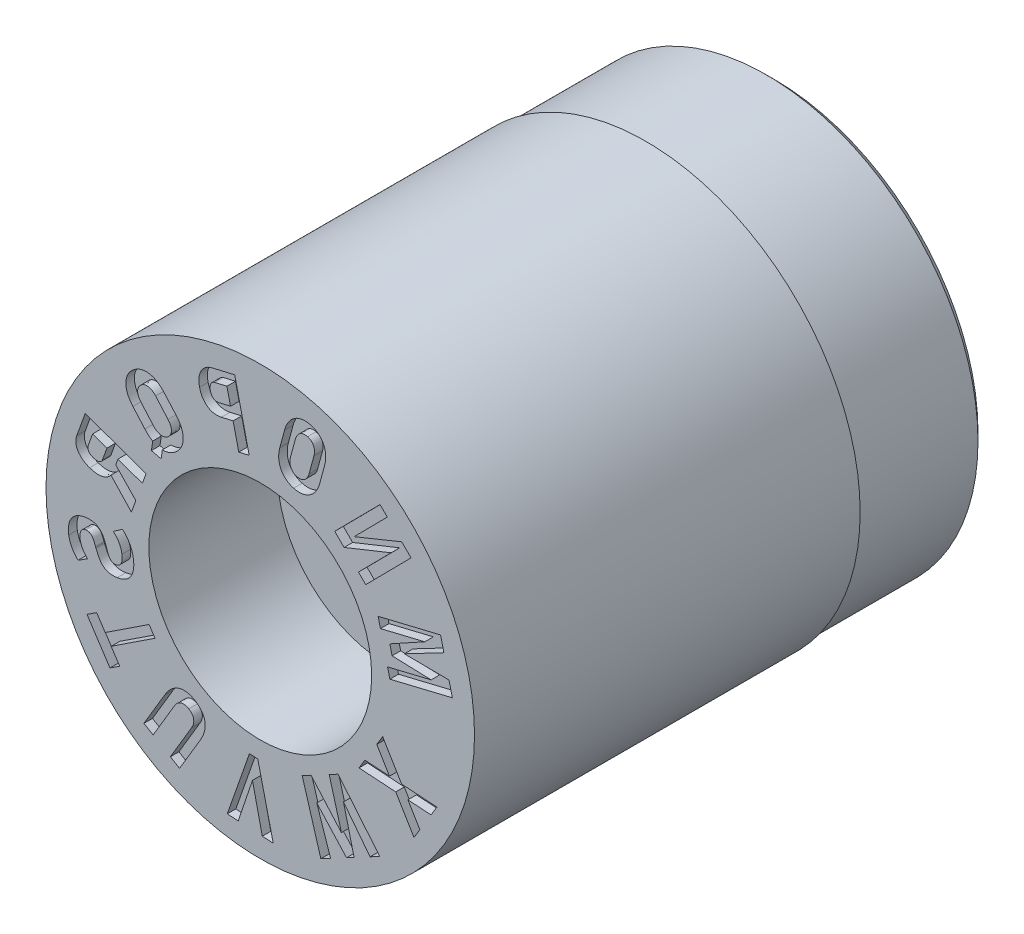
SolidWorks part; units mm, degrees
ref_plane "Front Plane" through (0, 0, 0) normal (0, 0, 1) x (1, 0, 0)
ref_plane "Top Plane" through (0, 0, 0) normal (0, 1, 0) x (1, 0, 0)
ref_plane "Right Plane" through (0, 0, 0) normal (1, 0, 0) x (0, 0, -1)
sketch "Sketch1" plane through (0, 0, 0) normal (1, 0, 0) x (0, 0, -1)
  line L2 (0, 5) -> (0, 2.6)
  line L3 (11.75, 5) -> (0, 5)
  line L4 (-3.7979, 0) -> (49996.2021, 0) construction
  line L8 (12, 1.25) -> (3, 1.25)
  line L9 (3, 2.6) -> (3, 1.25)
  line L10 (3, 2.6) -> (0, 2.6)
  line L12 (12, 1.25) -> (12, 4.75)
  line L16 (12, 4.75) -> (11.75, 5)
  dimension "D1" = 12
  dimension "D2" = 45
  dimension "D3" = 0.25
  dimension "D4" = 10
  dimension "D5" = 5.2
  dimension "D6" = 3
  dimension "D7" = 2.5
revolve "Revolve1" add sketch "Sketch1" angle 360 about L4
sketch "Sketch4" plane through (0, 0, 0) normal (1, 0, 0) x (0, 0, -1)
  line L0 (0, 0) -> (50000, 0) construction
  line L1 (12, -4.75) -> (12, 4.75) construction
  line L2 (9, 5.935) -> (12, 5.935)
  line L3 (9, 5.935) -> (9, 4.935)
  line L4 (9, 4.935) -> (12, 4.935)
  line L5 (12, 5.935) -> (12, 4.935)
  line L6 (11.75, 5) -> (0, 5) construction
  line L9 (0, 5.5) -> (0, -5.5) construction
  dimension "D1" = 1
  dimension "D2" = 0.065
  dimension "D3" = 9
revolve "Cut-Revolve1" cut sketch "Sketch4" angle 360 about L0
sketch "Sketch5" plane through (0, 0, 0) normal (0, 0, 1) x (1, 0, 0)
  line L0 (4.2863, 1.3069) -> (4.2086, 1.6274)
  line L1 (4.2086, 1.6274) -> (2.7506, 1.275)
  line L2 (2.7506, 1.275) -> (2.8042, 1.0542)
  line L3 (2.8042, 1.0542) -> (3.8391, 1.3043)
  line L5 (3.8391, 1.3043) -> (3.0244, 0.8554)
  line L6 (3.0244, 0.8554) -> (3.0763, 0.6405)
  line L7 (3.0763, 0.6405) -> (3.987, 0.6087)
  line L9 (3.987, 0.6087) -> (2.9712, 0.3633)
  line L10 (2.9712, 0.3633) -> (3.0249, 0.1421)
  line L11 (3.0249, 0.1421) -> (4.4829, 0.4945)
  line L12 (4.4829, 0.4945) -> (4.4051, 0.8149)
  line L13 (4.4051, 0.8149) -> (3.363, 0.8236)
  line L14 (3.363, 0.8236) -> (4.2863, 1.3069)
  line L15 (3.5191, 2.8404) -> (3.3012, 3.0557)
  line L16 (3.3012, 3.0557) -> (2.191, 2.6049)
  line L18 (2.191, 2.6049) -> (2.9654, 3.3881)
  line L19 (2.9654, 3.3881) -> (2.7954, 3.5562)
  line L20 (2.7954, 3.5562) -> (1.7379, 2.4868)
  line L21 (1.7379, 2.4868) -> (1.9566, 2.2703)
  line L22 (1.9566, 2.2703) -> (3.0543, 2.711)
  line L24 (3.0543, 2.711) -> (2.2913, 1.9394)
  line L25 (2.2913, 1.9394) -> (2.4615, 1.771)
  line L26 (2.4615, 1.771) -> (3.5191, 2.8404)
  line L27 (1.3901, 3.2863) -> (1.5008, 3.6955)
  line L28 (0.5676, 3.9476) -> (0.4569, 3.5384)
  line L29 (0.7045, 3.4642) -> (0.8189, 3.8872)
  line L30 (1.2534, 3.77) -> (1.1389, 3.347)
  line L31 (-0.694, 3.7981) -> (-0.9749, 3.733)
  line L32 (-1.059, 4.0961) -> (-0.7781, 4.1612)
  line L33 (-0.6327, 3.5334) -> (-0.5016, 2.9677)
  line L34 (-3.3213, 1.4174) -> (-2.7509, 1.2119)
  line L35 (-0.9072, 3.4698) -> (-0.6327, 3.5334)
  line L36 (-3.618, -2.2367) -> (-3.8174, -1.9339)
  line L37 (-0.5961, 4.4821) -> (-1.1138, 4.3622)
  line L38 (-0.7781, 4.1612) -> (-0.694, 3.7981)
  line L39 (-0.5016, 2.9677) -> (-0.2583, 3.024)
  line L40 (-0.2583, 3.024) -> (-0.5961, 4.4821)
  line L42 (-2.51, 2.1875) -> (-2.5402, 1.9795)
  line L43 (-2.5402, 1.9795) -> (-2.3131, 1.9239)
  line L44 (-2.3131, 1.9239) -> (-2.2848, 2.1221)
  line L45 (-1.962, 2.98) -> (-2.2422, 3.2987)
  line L46 (-2.9724, 2.6569) -> (-2.6922, 2.3382)
  line L47 (-2.4921, 2.5047) -> (-2.7818, 2.8338)
  line L48 (-2.4423, 3.1322) -> (-2.1526, 2.8031)
  line L49 (-3.5785, 1.5101) -> (-3.6842, 1.217)
  line L50 (-4.0176, 1.337) -> (-3.9119, 1.6302)
  line L52 (-4.0845, 1.9588) -> (-4.2819, 1.4106)
  line L53 (-3.3727, 1.2746) -> (-3.3213, 1.4174)
  line L56 (-3.9119, 1.6302) -> (-3.5785, 1.5101)
  line L57 (-2.7509, 1.2119) -> (-2.6659, 1.4477)
  line L58 (-2.6659, 1.4477) -> (-4.0845, 1.9588)
  line L60 (-3.4837, 1.0113) -> (-3.0069, 0.5014)
  line L61 (-3.0069, 0.5014) -> (-2.9039, 0.787)
  line L62 (-2.9039, 0.787) -> (-3.3727, 1.2746)
  line L63 (-3.2157, 0.0498) -> (-3.4296, -0.099)
  line L64 (-3.3686, -0.7404) -> (-3.3695, -0.7407)
  line L65 (-3.5814, -0.5246) -> (-3.5871, -0.5053)
  line L66 (-4.0825, -0.1395) -> (-4.0837, -0.1399)
  line L67 (-4.2525, -1.0932) -> (-4.0304, -0.9538)
  line L68 (-4.0745, -0.3902) -> (-4.0733, -0.3902)
  line L69 (-3.3398, -0.9882) -> (-3.3377, -0.9879)
  line L71 (-3.4801, -2.4461) -> (-2.4564, -1.7722)
  line L72 (-2.4564, -1.7722) -> (-2.5944, -1.5629)
  line L73 (-2.5944, -1.5629) -> (-3.618, -2.2367)
  line L74 (-4.0442, -2.0834) -> (-3.5076, -2.8983)
  line L75 (-3.5076, -2.8983) -> (-3.2807, -2.7489)
  line L76 (-3.2807, -2.7489) -> (-3.4801, -2.4461)
  line L77 (-3.8174, -1.9339) -> (-4.0442, -2.0834)
  line L78 (-2.2251, -2.7968) -> (-2.7148, -3.6211)
  line L79 (-2.7148, -3.6211) -> (-2.5002, -3.7485)
  line L80 (-2.5002, -3.7485) -> (-2.0067, -2.9177)
  line L81 (-1.6042, -3.1568) -> (-2.0976, -3.9876)
  line L82 (-2.0976, -3.9876) -> (-1.8833, -4.1152)
  line L83 (-1.8833, -4.1152) -> (-1.3936, -3.291)
  line L84 (-0.7696, -4.4781) -> (-0.5138, -4.4916)
  line L85 (-0.5138, -4.4916) -> (-0.1812, -3.5057)
  line L86 (-0.1812, -3.5057) -> (0.0471, -4.521)
  line L87 (0.0471, -4.521) -> (0.3029, -4.5342)
  line L88 (0.3029, -4.5342) -> (-0.058, -3.0114)
  line L89 (-0.058, -3.0114) -> (-0.2521, -3.0012)
  line L90 (-0.2521, -3.0012) -> (-0.7696, -4.4781)
  line L91 (2.0133, -3.9732) -> (2.1899, -3.8788)
  line L92 (2.1899, -3.8788) -> (1.9428, -2.8793)
  line L93 (1.9428, -2.8793) -> (2.5627, -3.6796)
  line L94 (2.5627, -3.6796) -> (2.7894, -3.5588)
  line L95 (2.7894, -3.5588) -> (1.8159, -2.3826)
  line L96 (1.8159, -2.3826) -> (1.609, -2.4932)
  line L97 (1.609, -2.4932) -> (1.8941, -3.5255)
  line L98 (1.8941, -3.5255) -> (1.1853, -2.7193)
  line L99 (1.1853, -2.7193) -> (0.9785, -2.8299)
  line L100 (0.9785, -2.8299) -> (1.4139, -4.2932)
  line L101 (1.4139, -4.2932) -> (1.6402, -4.1722)
  line L102 (1.6402, -4.1722) -> (1.3202, -3.2118)
  line L103 (1.3202, -3.2118) -> (2.0133, -3.9732)
  line L105 (3.1621, -2.0673) -> (3.5872, -2.7775)
  line L106 (3.5872, -2.7775) -> (3.7244, -2.5515)
  line L107 (3.7244, -2.5515) -> (3.4456, -2.0857)
  line L109 (3.2987, -1.841) -> (2.8571, -1.1022)
  line L110 (2.8571, -1.1022) -> (2.7195, -1.3283)
  line L111 (2.7195, -1.3283) -> (3.0157, -1.8226)
  line L112 (3.4456, -2.0857) -> (3.9859, -2.1208)
  line L113 (3.9859, -2.1208) -> (4.1232, -1.8948)
  line L114 (4.1232, -1.8948) -> (3.2987, -1.841)
  line L115 (3.0157, -1.8226) -> (2.4421, -1.7853)
  line L116 (2.4421, -1.7853) -> (2.3047, -2.0118)
  line L117 (2.3047, -2.0118) -> (3.1621, -2.0673)
  circle A0 centre (0, 0) radius 3.0592 construction
  spline S0 degree 3 poles (0.7798, 2.8798) (0.8024, 2.8742) (0.8362, 2.8663) (0.8816, 2.8622) (0.9147, 2.861) (0.9474, 2.8619) (0.9796, 2.8656) (1.0113, 2.8714) (1.0425, 2.8796) (1.0729, 2.8901) (1.1023, 2.9026) (1.1307, 2.9173) (1.1581, 2.9341) (1.1845, 2.953) (1.2097, 2.974) (1.2342, 2.997) (1.2573, 3.0222) (1.2791, 3.0493) (1.2993, 3.0783) (1.3186, 3.1086) (1.3359, 3.1409) (1.3517, 3.1749) (1.371, 3.223) (1.3835, 3.2605) (1.3901, 3.2863) knots 0 0 0 0 0.084854 0.125633 0.16558 0.205361 0.244558 0.283175 0.322471 0.36161 0.399992 0.438636 0.477754 0.516725 0.556575 0.597135 0.638485 0.68082 0.723586 0.766957 0.81144 0.856452 0.90324 1 1 1 1
  spline S1 degree 3 poles (1.5008, 3.6955) (1.5141, 3.7456) (1.528, 3.8209) (1.5283, 3.9206) (1.5214, 3.9793) (1.5118, 4.0242) (1.5023, 4.0563) (1.4913, 4.0873) (1.4782, 4.117) (1.4625, 4.145) (1.4457, 4.1721) (1.4265, 4.1978) (1.4053, 4.222) (1.3826, 4.245) (1.358, 4.2659) (1.3321, 4.2853) (1.3045, 4.3028) (1.2753, 4.3184) (1.2335, 4.3368) (1.2008, 4.348) (1.1782, 4.354) knots 0 0 0 0 0.188634 0.276447 0.361357 0.403048 0.443403 0.483105 0.522381 0.561263 0.599706 0.638378 0.677507 0.716596 0.755761 0.794913 0.83421 0.874247 0.91524 1 1 1 1
  spline S2 degree 3 poles (1.1782, 4.354) (1.1557, 4.3605) (1.1217, 4.3669) (1.0764, 4.3722) (1.0431, 4.3732) (1.0104, 4.3723) (0.9783, 4.3686) (0.9465, 4.3628) (0.9155, 4.3545) (0.885, 4.3444) (0.8556, 4.3316) (0.8273, 4.3169) (0.7997, 4.3004) (0.7735, 4.2812) (0.7481, 4.2603) (0.7239, 4.2369) (0.7007, 4.2117) (0.679, 4.1844) (0.6582, 4.1558) (0.6395, 4.1252) (0.6223, 4.093) (0.6059, 4.0592) (0.5867, 4.0109) (0.5742, 3.9734) (0.5676, 3.9476) knots 0 0 0 0 0.084835 0.125779 0.165706 0.205468 0.244647 0.283245 0.322521 0.361362 0.400022 0.438647 0.477421 0.516711 0.556542 0.596979 0.638671 0.680985 0.723764 0.767103 0.811194 0.856522 0.903287 1 1 1 1
  spline S3 degree 3 poles (0.4569, 3.5384) (0.4434, 3.4883) (0.4299, 3.413) (0.4299, 3.3134) (0.4366, 3.2549) (0.4464, 3.2101) (0.4554, 3.1778) (0.4671, 3.1472) (0.4798, 3.1173) (0.4953, 3.0892) (0.5122, 3.0621) (0.5313, 3.0364) (0.5525, 3.0122) (0.5753, 2.9892) (0.5999, 2.9683) (0.6258, 2.9489) (0.6534, 2.9314) (0.6828, 2.9158) (0.7243, 2.8967) (0.7573, 2.8859) (0.7798, 2.8798) knots 0 0 0 0 0.188814 0.276321 0.361246 0.40242 0.443038 0.482795 0.521777 0.560858 0.599307 0.637986 0.677121 0.716217 0.755389 0.794547 0.833851 0.874265 0.915226 1 1 1 1
  spline S4 degree 3 poles (0.8535, 3.1521) (0.833, 3.1579) (0.8034, 3.1694) (0.7694, 3.1932) (0.7473, 3.2137) (0.7288, 3.2376) (0.7133, 3.2637) (0.7027, 3.2929) (0.6946, 3.324) (0.6913, 3.3573) (0.6917, 3.4046) (0.6982, 3.4404) (0.7045, 3.4642) knots 0 0 0 0 0.164569 0.241873 0.319306 0.396246 0.474065 0.552893 0.635179 0.721192 0.809933 1 1 1 1
  spline S5 degree 3 poles (0.8189, 3.8872) (0.8253, 3.911) (0.8377, 3.9452) (0.861, 3.9863) (0.8808, 4.0132) (0.9032, 4.0363) (0.9273, 4.056) (0.9537, 4.0713) (0.9818, 4.0822) (1.0112, 4.0891) (1.0527, 4.0924) (1.0841, 4.0876) (1.1047, 4.0819) knots 0 0 0 0 0.189969 0.278747 0.364115 0.446619 0.525697 0.603457 0.680631 0.757324 0.835779 1 1 1 1
  spline S6 degree 3 poles (1.1047, 4.0819) (1.1252, 4.0766) (1.1547, 4.0649) (1.1889, 4.0412) (1.2107, 4.0202) (1.2294, 3.9966) (1.2446, 3.9704) (1.2553, 3.9412) (1.2629, 3.91) (1.2667, 3.8769) (1.2661, 3.8295) (1.2597, 3.7938) (1.2534, 3.77) knots 0 0 0 0 0.164009 0.24213 0.319774 0.396746 0.473914 0.552775 0.63566 0.721078 0.809855 1 1 1 1
  spline S7 degree 3 poles (1.1389, 3.347) (1.1326, 3.3232) (1.1202, 3.289) (1.0968, 3.2478) (1.077, 3.2208) (1.0546, 3.1977) (1.0305, 3.1781) (1.0042, 3.163) (0.9763, 3.1517) (0.9468, 3.1451) (0.9054, 3.1423) (0.8739, 3.1462) (0.8535, 3.1521) knots 0 0 0 0 0.190103 0.278943 0.365153 0.447715 0.526115 0.60393 0.680672 0.757993 0.836057 1 1 1 1
  spline S8 degree 3 poles (-0.9749, 3.733) (-0.9887, 3.73) (-1.0099, 3.7277) (-1.0375, 3.7316) (-1.0572, 3.7374) (-1.0757, 3.7465) (-1.0935, 3.7576) (-1.1093, 3.7724) (-1.124, 3.7893) (-1.1373, 3.8087) (-1.152, 3.8385) (-1.1602, 3.8626) (-1.1638, 3.8795) knots 0 0 0 0 0.159217 0.234811 0.31068 0.387798 0.46505 0.544886 0.628703 0.716277 0.806375 1 1 1 1
  spline S9 degree 3 poles (-1.1638, 3.8795) (-1.1681, 3.8965) (-1.1715, 3.9221) (-1.1714, 3.9557) (-1.1684, 3.9791) (-1.1629, 4.0011) (-1.1552, 4.0215) (-1.1447, 4.0397) (-1.1319, 4.0559) (-1.1167, 4.0699) (-1.0932, 4.0855) (-1.0731, 4.0931) (-1.059, 4.0961) knots 0 0 0 0 0.194026 0.28503 0.371572 0.455815 0.535818 0.612326 0.688684 0.764158 0.840582 1 1 1 1
  spline S10 degree 3 poles (-1.1138, 4.3622) (-1.1521, 4.3533) (-1.2073, 4.3342) (-1.2724, 4.2941) (-1.3146, 4.2584) (-1.3508, 4.2175) (-1.3812, 4.1718) (-1.4046, 4.1215) (-1.4212, 4.0671) (-1.4317, 4.0092) (-1.4344, 3.9262) (-1.4263, 3.8632) (-1.4163, 3.8212) knots 0 0 0 0 0.169181 0.248916 0.327591 0.405822 0.483634 0.562501 0.64375 0.727835 0.814528 1 1 1 1
  spline S11 degree 3 poles (-1.4163, 3.8212) (-1.407, 3.779) (-1.3865, 3.7186) (-1.3471, 3.6457) (-1.3126, 3.5982) (-1.2736, 3.5571) (-1.2305, 3.5224) (-1.1835, 3.4947) (-1.1327, 3.4744) (-1.0793, 3.4613) (-1.0033, 3.4537) (-0.9454, 3.4614) (-0.9072, 3.4698) knots 0 0 0 0 0.186189 0.272787 0.356605 0.438128 0.516309 0.594256 0.672298 0.751181 0.830638 1 1 1 1
  spline S12 degree 3 poles (-1.9623, 2.2449) (-1.945, 2.2606) (-1.9198, 2.2846) (-1.8907, 2.32) (-1.8714, 2.3472) (-1.8543, 2.3752) (-1.8389, 2.4039) (-1.8262, 2.4337) (-1.8124, 2.4744) (-1.8005, 2.527) (-1.796, 2.5916) (-1.8007, 2.6574) (-1.8123, 2.7124) (-1.826, 2.7564) (-1.839, 2.7894) (-1.8537, 2.8221) (-1.871, 2.8543) (-1.8902, 2.8865) (-1.9197, 2.9293) (-1.9444, 2.9601) (-1.962, 2.98) knots 0 0 0 0 0.08482 0.125834 0.166007 0.205706 0.244763 0.283952 0.323161 0.400716 0.478449 0.55723 0.639391 0.681721 0.724221 0.767703 0.811694 0.856943 0.90353 1 1 1 1
  spline S13 degree 3 poles (-2.2422, 3.2987) (-2.2767, 3.3374) (-2.3318, 3.3907) (-2.4148, 3.4459) (-2.4676, 3.4729) (-2.5107, 3.489) (-2.5427, 3.4992) (-2.5748, 3.5067) (-2.6068, 3.5122) (-2.6389, 3.5151) (-2.671, 3.5155) (-2.7031, 3.5138) (-2.7351, 3.5097) (-2.7666, 3.5028) (-2.7979, 3.4944) (-2.8284, 3.4831) (-2.8583, 3.4694) (-2.8878, 3.4537) (-2.9263, 3.4289) (-2.954, 3.4079) (-2.9714, 3.3922) knots 0 0 0 0 0.188187 0.275929 0.360881 0.402284 0.442801 0.482544 0.521736 0.56056 0.599241 0.637939 0.676924 0.71607 0.754979 0.794146 0.834133 0.874121 0.915041 1 1 1 1
  spline S14 degree 3 poles (-2.9714, 3.3922) (-2.989, 3.3767) (-3.0137, 3.352) (-3.0434, 3.317) (-3.0625, 3.2897) (-3.0799, 3.2619) (-3.095, 3.2331) (-3.108, 3.2034) (-3.1216, 3.1627) (-3.1339, 3.1103) (-3.1383, 3.0456) (-3.1337, 2.9799) (-3.122, 2.925) (-3.1082, 2.881) (-3.0956, 2.848) (-3.0805, 2.8153) (-3.0634, 2.7829) (-3.0441, 2.7507) (-3.0145, 2.7079) (-2.9902, 2.6768) (-2.9724, 2.6569) knots 0 0 0 0 0.085083 0.126278 0.166434 0.20578 0.245168 0.283985 0.323178 0.400735 0.478436 0.557185 0.638964 0.681276 0.724083 0.767234 0.811508 0.856738 0.903306 1 1 1 1
  spline S15 degree 3 poles (-2.6922, 2.3382) (-2.6577, 2.2996) (-2.6027, 2.2462) (-2.5365, 2.2024) (-2.5128, 2.189) (-2.51, 2.1875) knots 0 0 0 0 0.188096 0.275632 0.286883 0.286883 0.286883 0.286883
  spline S16 degree 3 poles (-2.1488, 2.4568) (-2.1647, 2.4422) (-2.1914, 2.4246) (-2.2301, 2.4087) (-2.2596, 2.4017) (-2.2896, 2.399) (-2.32, 2.4011) (-2.3504, 2.408) (-2.3806, 2.4191) (-2.4103, 2.4344) (-2.4497, 2.4607) (-2.4759, 2.4861) (-2.4921, 2.5047) knots 0 0 0 0 0.165329 0.24357 0.3207 0.397703 0.474638 0.554093 0.636026 0.721784 0.810093 1 1 1 1
  spline S17 degree 3 poles (-2.7818, 2.8338) (-2.7982, 2.8524) (-2.8196, 2.8818) (-2.8411, 2.9241) (-2.8524, 2.9554) (-2.8597, 2.9867) (-2.8622, 3.0177) (-2.8601, 3.0481) (-2.8539, 3.0777) (-2.8433, 3.1063) (-2.823, 3.1429) (-2.8013, 3.1665) (-2.7852, 3.1807) knots 0 0 0 0 0.190296 0.278273 0.363742 0.44551 0.524772 0.601669 0.679459 0.756595 0.834986 1 1 1 1
  spline S18 degree 3 poles (-2.7852, 3.1807) (-2.7692, 3.1948) (-2.7429, 3.2128) (-2.7042, 3.2285) (-2.6746, 3.2355) (-2.6444, 3.2378) (-2.6141, 3.2357) (-2.5837, 3.2293) (-2.5535, 3.2181) (-2.5239, 3.2028) (-2.4849, 3.176) (-2.4584, 3.1509) (-2.4423, 3.1322) knots 0 0 0 0 0.164324 0.242648 0.320594 0.397515 0.474532 0.554006 0.636026 0.721138 0.809891 1 1 1 1
  spline S19 degree 3 poles (-2.1526, 2.8031) (-2.1365, 2.7845) (-2.1146, 2.7554) (-2.0933, 2.7131) (-2.0819, 2.6818) (-2.0747, 2.6503) (-2.0722, 2.6193) (-2.0739, 2.5889) (-2.0802, 2.5593) (-2.0911, 2.5309) (-2.1113, 2.4944) (-2.1328, 2.4708) (-2.1488, 2.4568) knots 0 0 0 0 0.189978 0.278085 0.363682 0.446309 0.525689 0.602752 0.679876 0.757305 0.835813 1 1 1 1
  spline S20 degree 3 poles (-3.6842, 1.217) (-3.6882, 1.2054) (-3.6967, 1.1891) (-3.7131, 1.1713) (-3.7275, 1.1604) (-3.7437, 1.1516) (-3.7614, 1.1445) (-3.781, 1.1405) (-3.802, 1.1388) (-3.8241, 1.1395) (-3.8555, 1.1431) (-3.8791, 1.1494) (-3.8948, 1.1547) knots 0 0 0 0 0.149319 0.221694 0.294551 0.369529 0.446511 0.527282 0.612762 0.703263 0.796934 1 1 1 1
  spline S21 degree 3 poles (-3.8948, 1.1547) (-3.9108, 1.1599) (-3.9328, 1.1706) (-3.96, 1.1871) (-3.977, 1.2011) (-3.9919, 1.2157) (-4.0045, 1.2311) (-4.0138, 1.2478) (-4.0208, 1.2649) (-4.0246, 1.2827) (-4.0256, 1.3071) (-4.0222, 1.3253) (-4.0176, 1.337) knots 0 0 0 0 0.203595 0.297556 0.386975 0.471746 0.551629 0.628662 0.703686 0.776223 0.848313 1 1 1 1
  spline S22 degree 3 poles (-4.2819, 1.4106) (-4.294, 1.378) (-4.3047, 1.3273) (-4.3045, 1.2593) (-4.2957, 1.2101) (-4.2802, 1.1625) (-4.2568, 1.1171) (-4.2268, 1.0743) (-4.1899, 1.0341) (-4.1464, 0.9976) (-4.0792, 0.952) (-4.022, 0.9267) (-3.9822, 0.9122) knots 0 0 0 0 0.159553 0.235612 0.311315 0.388075 0.465029 0.544636 0.627784 0.714856 0.805171 1 1 1 1
  spline S23 degree 3 poles (-3.9822, 0.9122) (-3.9425, 0.8973) (-3.8822, 0.8818) (-3.8017, 0.8728) (-3.7449, 0.8738) (-3.6909, 0.881) (-3.6403, 0.8946) (-3.5938, 0.9155) (-3.5512, 0.9422) (-3.5139, 0.9742) (-3.493, 0.9988) (-3.4837, 1.0113) knots 0 0 0 0 0.194722 0.284886 0.37192 0.455138 0.534537 0.611839 0.688719 0.76519 0.836633 0.836633 0.836633 0.836633
  spline S24 degree 3 poles (-2.9598, -0.4201) (-2.964, -0.3888) (-2.9741, -0.3426) (-2.9917, -0.2823) (-3.0076, -0.2382) (-3.0258, -0.1956) (-3.0466, -0.1546) (-3.0696, -0.1152) (-3.0951, -0.0778) (-3.1222, -0.0422) (-3.1614, 0.0014) (-3.1927, 0.032) (-3.2157, 0.0498) knots 0 0 0 0 0.172685 0.258677 0.344258 0.429171 0.512627 0.596052 0.678697 0.760721 0.840906 1 1 1 1
  spline S25 degree 3 poles (-3.4296, -0.099) (-3.4024, -0.1208) (-3.3654, -0.1579) (-3.3228, -0.2135) (-3.295, -0.2588) (-3.2712, -0.3065) (-3.2446, -0.3722) (-3.2327, -0.424) (-3.2276, -0.4589) knots 0 0 0 0 0.246996 0.371005 0.497151 0.624435 0.749538 1 1 1 1
  spline S26 degree 3 poles (-3.2276, -0.4589) (-3.2249, -0.478) (-3.2216, -0.5061) (-3.2219, -0.5428) (-3.2232, -0.5681) (-3.2264, -0.5919) (-3.2314, -0.6141) (-3.2379, -0.635) (-3.2465, -0.654) (-3.256, -0.6718) (-3.2679, -0.6873) (-3.2808, -0.7012) (-3.2953, -0.7133) (-3.3115, -0.7231) (-3.3357, -0.7336) (-3.3552, -0.7384) (-3.3686, -0.7404) knots 0 0 0 0 0.163212 0.238687 0.310057 0.377124 0.441113 0.5025 0.561162 0.617797 0.672569 0.725446 0.777915 0.831392 0.885228 1 1 1 1
  spline S27 degree 3 poles (-3.3695, -0.7407) (-3.3874, -0.7438) (-3.4139, -0.7437) (-3.4471, -0.7356) (-3.468, -0.7246) (-3.4866, -0.7107) (-3.5033, -0.6942) (-3.518, -0.6749) (-3.5307, -0.6528) (-3.5424, -0.6277) (-3.5588, -0.5883) (-3.5705, -0.5568) (-3.5778, -0.5344) knots 0 0 0 0 0.167077 0.241681 0.312795 0.383261 0.455172 0.528631 0.606108 0.689828 0.783416 1 1 1 1
  spline S28 degree 3 poles (-3.5778, -0.5344) (-3.5783, -0.5328) (-3.5794, -0.5295) (-3.5802, -0.526) (-3.5814, -0.5246) knots 0 0 0 0 0.496792 1 1 1 1
  spline S29 degree 3 poles (-3.5871, -0.5053) (-3.6004, -0.4657) (-3.6207, -0.409) (-3.6528, -0.3392) (-3.6765, -0.2943) (-3.7039, -0.2541) (-3.7377, -0.2193) (-3.7774, -0.1886) (-3.815, -0.167) (-3.8483, -0.1527) (-3.8758, -0.1438) (-3.9054, -0.1378) (-3.9369, -0.1335) (-3.9704, -0.1318) (-4.0194, -0.1321) (-4.0569, -0.1359) (-4.0825, -0.1395) knots 0 0 0 0 0.181067 0.260489 0.332708 0.40112 0.470234 0.542037 0.617915 0.65743 0.699065 0.742723 0.788179 0.836915 0.887918 1 1 1 1
  spline S30 degree 3 poles (-4.0837, -0.1399) (-4.1069, -0.143) (-4.1408, -0.15) (-4.1844, -0.1622) (-4.2149, -0.1732) (-4.2439, -0.1855) (-4.2715, -0.1993) (-4.2974, -0.2149) (-4.3216, -0.2323) (-4.344, -0.2511) (-4.3652, -0.271) (-4.3843, -0.2925) (-4.4014, -0.3157) (-4.4175, -0.3397) (-4.431, -0.3656) (-4.4434, -0.3926) (-4.4572, -0.431) (-4.4703, -0.4825) (-4.4798, -0.5735) (-4.4764, -0.6442) (-4.469, -0.6921) knots 0 0 0 0 0.091894 0.135435 0.177445 0.218865 0.259058 0.298297 0.337205 0.375493 0.413186 0.450869 0.488257 0.525951 0.564082 0.602598 0.642304 0.723962 0.810241 1 1 1 1
  spline S31 degree 3 poles (-4.469, -0.6921) (-4.4658, -0.716) (-4.4575, -0.7516) (-4.4434, -0.7987) (-4.4254, -0.8462) (-4.3977, -0.9048) (-4.3428, -0.995) (-4.2909, -1.056) (-4.2525, -1.0932) knots 0 0 0 0 0.156128 0.235901 0.317864 0.484671 0.654494 1 1 1 1
  spline S32 degree 3 poles (-4.0304, -0.9538) (-4.0532, -0.9318) (-4.085, -0.8968) (-4.1217, -0.8466) (-4.1459, -0.8084) (-4.1658, -0.7695) (-4.1875, -0.7188) (-4.1971, -0.6793) (-4.2012, -0.6533) knots 0 0 0 0 0.2704 0.40157 0.530661 0.655468 0.774418 1 1 1 1
  spline S33 degree 3 poles (-4.2012, -0.6533) (-4.2064, -0.6192) (-4.2091, -0.5699) (-4.1997, -0.5083) (-4.1882, -0.4761) (-4.1758, -0.4538) (-4.1654, -0.4392) (-4.1537, -0.4263) (-4.1405, -0.4154) (-4.1259, -0.4063) (-4.1042, -0.3965) (-4.0868, -0.3916) (-4.0745, -0.3902) knots 0 0 0 0 0.314658 0.447071 0.567546 0.624824 0.679207 0.731418 0.783129 0.835307 0.887973 1 1 1 1
  spline S34 degree 3 poles (-4.0733, -0.3902) (-4.0539, -0.3871) (-4.0252, -0.3869) (-3.9894, -0.3956) (-3.9669, -0.4075) (-3.9471, -0.4224) (-3.9289, -0.4395) (-3.9137, -0.4595) (-3.9, -0.4818) (-3.8871, -0.5077) (-3.8677, -0.5508) (-3.8534, -0.5859) (-3.844, -0.611) knots 0 0 0 0 0.167349 0.241493 0.312252 0.38306 0.453191 0.524266 0.596439 0.676967 0.770953 1 1 1 1
  spline S35 degree 3 poles (-3.844, -0.611) (-3.8429, -0.6131) (-3.842, -0.618) (-3.8398, -0.6224) (-3.839, -0.6248) knots 0 0 0 0 0.478861 1 1 1 1
  spline S36 degree 3 poles (-3.839, -0.6248) (-3.8379, -0.6284) (-3.835, -0.635) (-3.8321, -0.6417) (-3.8311, -0.6451) knots 0 0 0 0 0.507004 1 1 1 1
  spline S37 degree 3 poles (-3.8311, -0.6451) (-3.8163, -0.6824) (-3.7948, -0.7362) (-3.7601, -0.8017) (-3.7349, -0.8444) (-3.7061, -0.8825) (-3.6715, -0.9152) (-3.6317, -0.9437) (-3.5945, -0.9637) (-3.5618, -0.9768) (-3.5352, -0.9845) (-3.5068, -0.9902) (-3.4768, -0.9941) (-3.4449, -0.9954) (-3.399, -0.995) (-3.3638, -0.9919) (-3.3398, -0.9882) knots 0 0 0 0 0.180519 0.259997 0.333498 0.403308 0.474159 0.546693 0.623198 0.663366 0.70482 0.747886 0.793456 0.84101 0.891072 1 1 1 1
  spline S38 degree 3 poles (-3.3377, -0.9879) (-3.315, -0.9843) (-3.2814, -0.9781) (-3.2385, -0.9653) (-3.2082, -0.9546) (-3.1796, -0.942) (-3.1525, -0.9276) (-3.127, -0.9115) (-3.1031, -0.8938) (-3.0805, -0.875) (-3.0602, -0.854) (-3.0412, -0.832) (-3.0242, -0.8083) (-3.0087, -0.7833) (-2.9953, -0.7566) (-2.9835, -0.7285) (-2.9698, -0.6888) (-2.9575, -0.6356) (-2.9479, -0.542) (-2.9526, -0.4693) (-2.9598, -0.4201) knots 0 0 0 0 0.089182 0.131807 0.173316 0.213508 0.252983 0.291963 0.330167 0.368157 0.40561 0.443269 0.480688 0.518415 0.556944 0.59621 0.636402 0.719477 0.807066 1 1 1 1
  spline S39 degree 3 poles (-1.5245, -2.5627) (-1.5458, -2.5502) (-1.5779, -2.5331) (-1.6221, -2.5148) (-1.6544, -2.5038) (-1.6869, -2.4957) (-1.719, -2.4899) (-1.751, -2.4862) (-1.7828, -2.4855) (-1.8143, -2.4869) (-1.8453, -2.491) (-1.876, -2.4971) (-1.9062, -2.506) (-1.9361, -2.5173) (-1.9652, -2.5313) (-1.9942, -2.5473) (-2.0225, -2.5661) (-2.0506, -2.5868) (-2.0777, -2.61) (-2.1039, -2.6356) (-2.1297, -2.6632) (-2.1548, -2.6933) (-2.1877, -2.7373) (-2.2108, -2.7723) (-2.2251, -2.7968) knots 0 0 0 0 0.088265 0.129982 0.170724 0.210436 0.249307 0.28752 0.325398 0.363047 0.400199 0.437199 0.474867 0.512747 0.551073 0.590431 0.631013 0.672602 0.715056 0.758555 0.803498 0.850122 0.898557 1 1 1 1
  spline S40 degree 3 poles (-2.0067, -2.9177) (-1.9965, -2.9001) (-1.9796, -2.8755) (-1.9546, -2.8459) (-1.9355, -2.8271) (-1.9158, -2.8107) (-1.8954, -2.7966) (-1.874, -2.7854) (-1.8521, -2.7766) (-1.8298, -2.7703) (-1.8072, -2.7666) (-1.7843, -2.7663) (-1.7612, -2.7679) (-1.738, -2.773) (-1.7058, -2.783) (-1.6826, -2.7946) (-1.6675, -2.8035) knots 0 0 0 0 0.150535 0.219854 0.285596 0.348467 0.408969 0.468424 0.526016 0.583153 0.639089 0.694959 0.751524 0.809722 0.870393 1 1 1 1
  spline S41 degree 3 poles (-1.6675, -2.8035) (-1.6525, -2.8128) (-1.6308, -2.8273) (-1.6066, -2.851) (-1.5908, -2.869) (-1.5782, -2.8888) (-1.5676, -2.9092) (-1.5597, -2.9309) (-1.5545, -2.9535) (-1.5513, -2.9769) (-1.5513, -3.0011) (-1.5536, -3.0257) (-1.5583, -3.0511) (-1.5661, -3.0768) (-1.5798, -3.113) (-1.5938, -3.1394) (-1.6042, -3.1568) knots 0 0 0 0 0.130261 0.190753 0.249004 0.306183 0.362454 0.418565 0.475334 0.533275 0.591998 0.652531 0.715434 0.781197 0.850345 1 1 1 1
  spline S42 degree 3 poles (-1.3936, -3.291) (-1.3791, -3.2665) (-1.3587, -3.2298) (-1.3364, -3.1796) (-1.322, -3.1432) (-1.3098, -3.1074) (-1.3001, -3.072) (-1.2926, -3.0371) (-1.2878, -3.0026) (-1.2847, -2.9687) (-1.285, -2.9355) (-1.2866, -2.9031) (-1.2915, -2.8716) (-1.298, -2.8406) (-1.307, -2.8105) (-1.3189, -2.7814) (-1.3326, -2.7529) (-1.3486, -2.7252) (-1.3674, -2.6989) (-1.3879, -2.6732) (-1.4107, -2.6488) (-1.436, -2.6256) (-1.4732, -2.5956) (-1.5032, -2.5749) (-1.5245, -2.5627) knots 0 0 0 0 0.101539 0.149563 0.196051 0.241106 0.284589 0.327167 0.368495 0.408959 0.448359 0.486932 0.524914 0.562096 0.599627 0.636991 0.674508 0.712359 0.750808 0.789986 0.829429 0.870156 0.912247 1 1 1 1
  spline S43 degree 3 poles (-2.2848, 2.1221) (-2.2775, 2.1219) (-2.2596, 2.1219) (-2.231, 2.1233) (-2.199, 2.1276) (-2.1673, 2.1339) (-2.1363, 2.1429) (-2.1057, 2.1542) (-2.0756, 2.1673) (-2.0463, 2.1836) (-2.0073, 2.2078) (-1.9801, 2.2297) (-1.9623, 2.2449) knots 0.572912 0.572912 0.572912 0.572912 0.59912 0.637799 0.676765 0.715771 0.754807 0.793955 0.83373 0.873914 0.915098 1 1 1 1
  dimension "D1" = 6.1184
extrude "Cut-Extrude1" cut sketch "Sketch5" against normal blind 0.2
